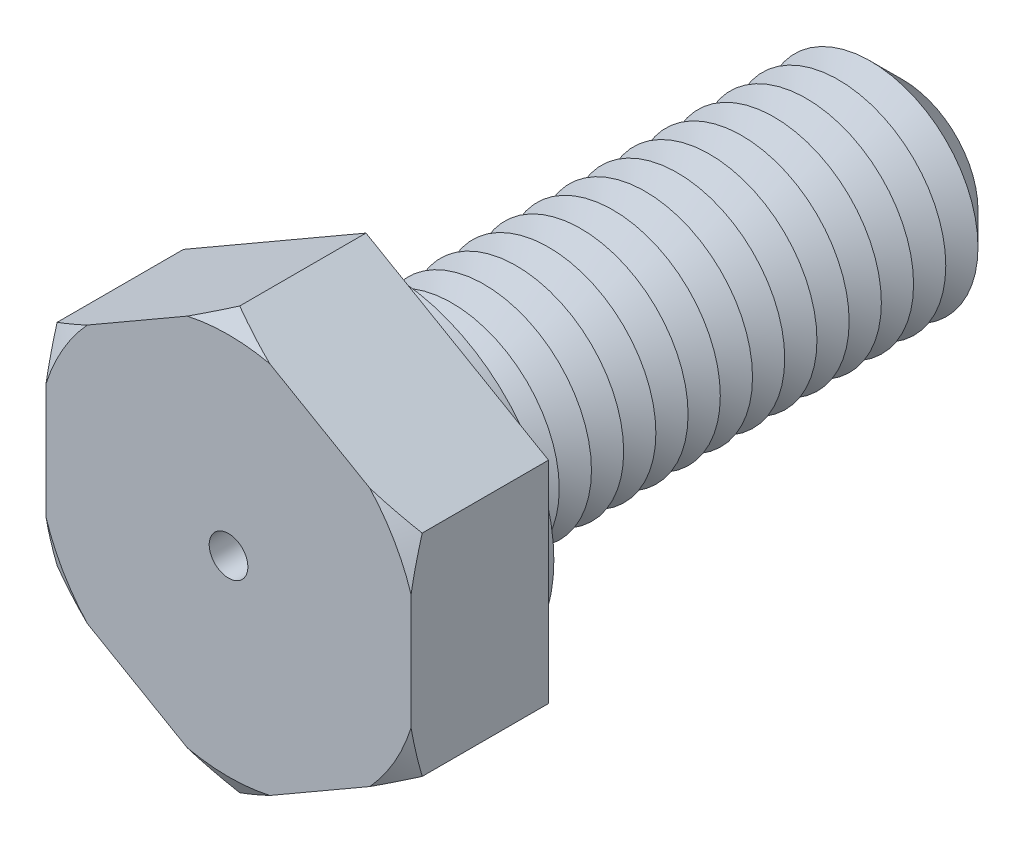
SolidWorks part; units mm, degrees
ref_plane "Front Plane" through (0, 0, 0) normal (0, 0, 1) x (1, 0, 0)
ref_plane "Top Plane" through (0, 0, 0) normal (0, 1, 0) x (1, 0, 0)
ref_plane "Right Plane" through (0, 0, 0) normal (1, 0, 0) x (0, 0, -1)
sketch "Sketch2" plane through (0, 0, 0) normal (0, 0, 1) x (1, 0, 0)
  line L1 (0, 9.815) -> (-8.5, 4.9075)
  line L2 (-8.5, 4.9075) -> (-8.5, -4.9075)
  line L3 (-8.5, -4.9075) -> (0, -9.815)
  line L4 (0, -9.815) -> (8.5, -4.9075)
  line L5 (8.5, -4.9075) -> (8.5, 4.9075)
  line L6 (8.5, 4.9075) -> (0, 9.815)
  circle A0 centre (0, 0) radius 8.5 construction
  dimension "D1" = 17
extrude "Boss-Extrude1" add sketch "Sketch2" along normal blind 6.4
sketch "Sketch3" plane through (0, 0, 0) normal (0, 0, -1) x (-1, 0, 0)
  circle A0 centre (0, 0) radius 5
  dimension "D1" = 10
extrude "Boss-Extrude2" add sketch "Sketch3" along normal blind 25
sketch "Sketch4" plane through (0, 0, 0) normal (0, 0, -1) x (-1, 0, 0)
  circle A0 centre (0, 0) radius 7.75
  dimension "D1" = 15.5
extrude "Boss-Extrude3" add sketch "Sketch4" along normal blind 1
sketch "Sketch5" plane through (0, 0, 0) normal (1, 0, 0) x (0, 0, -1)
  line L0 (-3.2117, 0) -> (6.3192, 0) construction
chamfer "Chamfer1" distance 1.5 angle 45 1 edges at (-5, 0, -25)
sketch "Sketch6" plane through (0, 0, 0) normal (1, 0, 0) x (0, 0, -1)
  line L0 (1, 5) -> (1.75, 3.701)
  line L1 (1.75, 3.701) -> (2.5, 5)
  line L2 (23.5, 5) -> (1, 5) construction
  line L3 (2.5, 5) -> (1, 5)
  dimension "D1" = 1.5
revolve "Cut-Revolve1" cut sketch "Sketch6" angle 360 about L0
pattern_linear "LPattern1" count 15 spacing 1.5 along (0, 0, -1) of "Cut-Revolve1"
sketch "Sketch7" plane through (0, 0, 0) normal (1, 0, 0) x (0, 0, -1)
  line L0 (-6.4, 9.815) -> (-6.4, 8.915)
  line L1 (-6.4, 4.9075) -> (-6.4, 9.815) construction
  line L2 (-6.4, 8.915) -> (-5.8804, 9.815)
  line L3 (-6.4, 9.815) -> (0, 9.815) construction
  line L4 (-5.8804, 9.815) -> (-6.4, 9.815)
  dimension "D1" = 0.9
  dimension "D2" = 30
revolve "Cut-Revolve2" cut sketch "Sketch7" angle 360 about L0
sketch "Sketch8" plane through (0, 0, 6.4) normal (0, 0, 1) x (1, 0, 0)
  circle A0 centre (0, 0) radius 0.9
  dimension "D1" = 1.8
extrude "Cut-Extrude1" cut sketch "Sketch8" against normal up to surface (31.4 mm away)
